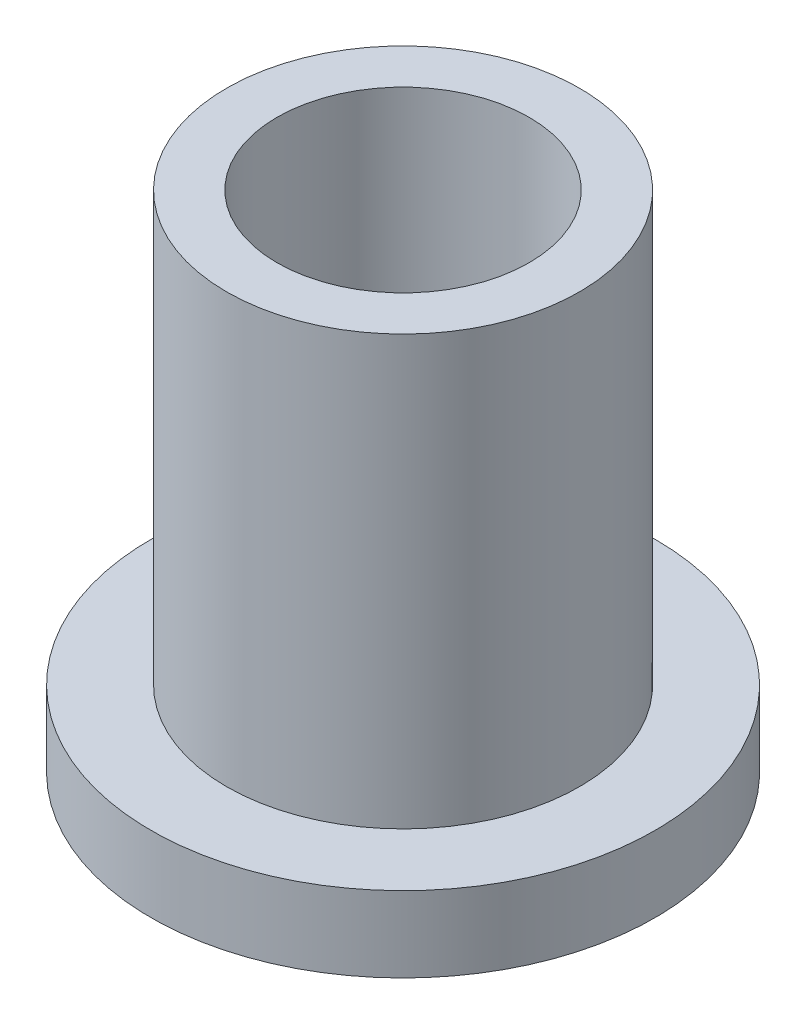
SolidWorks part; units mm, degrees
ref_plane "Front" through (0, 0, 0) normal (0, 0, 1) x (1, 0, 0)
ref_plane "Top" through (0, 0, 0) normal (0, 1, 0) x (1, 0, 0)
ref_plane "Right" through (0, 0, 0) normal (1, 0, 0) x (0, 0, -1)
sketch "Sketch1" plane through (0, 0, 0) normal (0, 1, 0) x (1, 0, 0)
  circle A0 centre (0, 0) radius 7.9375
  circle A1 centre (0, 0) radius 11.1125
  circle A2 centre (0, 0) radius 15.875
  dimension "ID" = 15.875
  dimension "OD" = 22.225
  dimension "FlangeOD" = 31.75
sketch "Sketch2" plane through (0, 0, 0) normal (0, 1, 0) x (1, 0, 0)
  circle A0 centre (0, 0) radius 7.9375 construction
  circle A1 centre (0, 0) radius 11.1125 construction
  circle A2 centre (0, 0) radius 7.9375
  circle A3 centre (0, 0) radius 11.1125
extrude "Boss-Extrude1" add sketch "Sketch2" along normal blind 31.75
sketch "Sketch3" plane through (0, 0, 0) normal (0, 1, 0) x (1, 0, 0)
  circle A0 centre (0, 0) radius 15.875 construction
  circle A1 centre (0, 0) radius 11.1125 construction
  circle A2 centre (0, 0) radius 15.875
  circle A3 centre (0, 0) radius 11.1125
extrude "Boss-Extrude2" add sketch "Sketch3" along normal blind 4.7625
